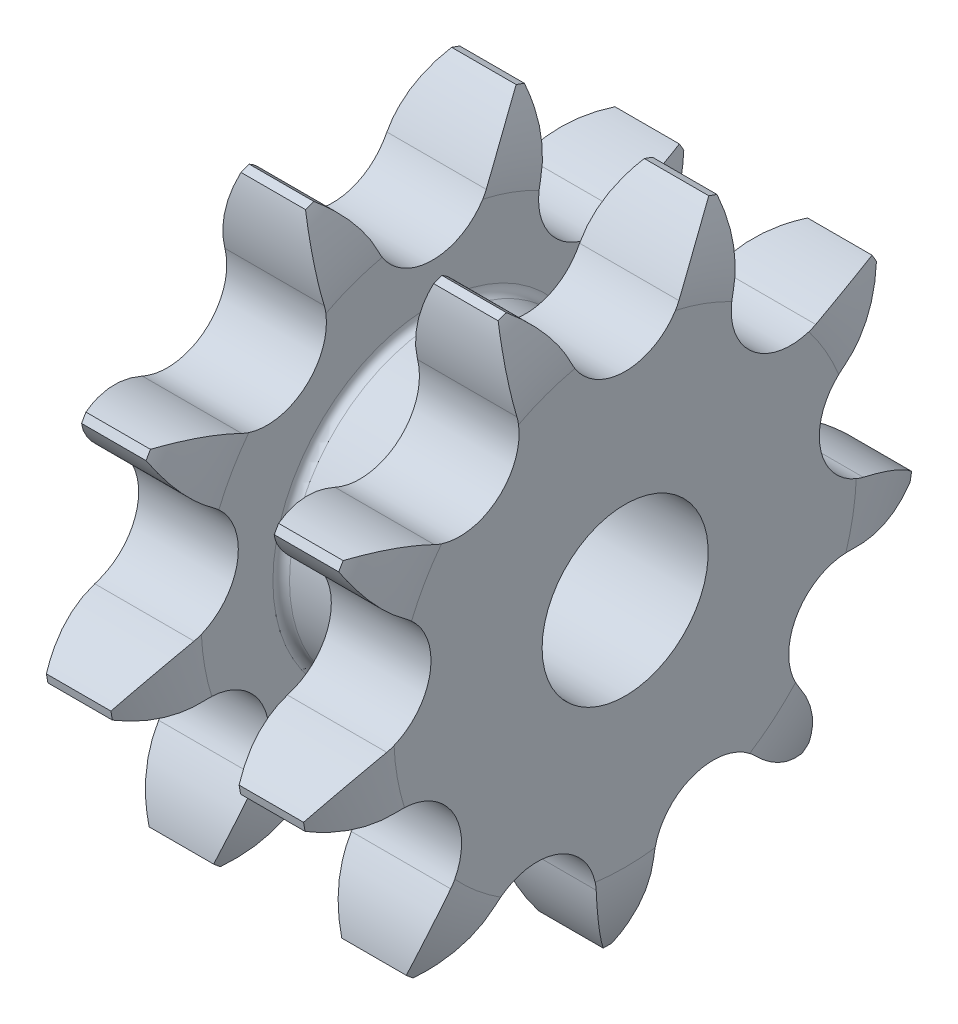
SolidWorks part; units mm, degrees
ref_plane "Plane1" through (0, 0, 0) normal (0, 0, 1) x (1, 0, 0)
ref_plane "Plane2" through (0, 0, 0) normal (0, 1, 0) x (1, 0, 0)
ref_plane "Plane3" through (0, 0, 0) normal (1, 0, 0) x (0, 0, -1)
sketch "Clipboard" plane through (0, 0, 0) normal (0, 1, 0) x (1, 0, 0)
  line L0 (0, 0) -> (12.5436, -1.9867)
  line L1 (-15, 0) -> (100, 0) construction
  line L2 (0, 0) -> (-0.8416, 0.9512)
  line L3 (0, 0) -> (-11.863, 4.5341)
  line L4 (0, 0) -> (3.0618, 0.4849)
  line L5 (0, 0) -> (-2.8109, -1.0484)
  line L6 (0, 0) -> (-17.5077, -11.8125)
  line L7 (-0.8416, 0.9512) -> (22.0505, 5.4009)
  line L8 (-76.2, 38.1) -> (-75.2, 38.1)
  line L9 (-73.4259, 41.6592) -> (-72.8306, 41.7344)
  line L10 (-73.4741, 12.7512) -> (-59.5541, 12.7512)
  circle A0 centre (0, 0) radius 4.255
  circle A1 centre (0, 0) radius 10.9305
  circle A2 centre (0, 0) radius 25
  dimension "Dr" = 8.51
  dimension "MHD" = 21.861
  dimension "Hub_dia" = 50
  dimension "Num_teeth" = 9
  dimension "Pitch" = 12.7
  dimension "Width" = 3.1
  dimension "Side_relief" = 1.27
  dimension "Side_radius" = 12.7
  dimension "Overall_len" = 3
  dimension "Show_teeth" = 9
  dimension "Thickness" = 21.12
  dimension "OAL" = 23.3205
  dimension "T_dim" = 1
  dimension "Fillet_rad" = 0.6
  dimension "Face_width" = 7.2
  dimension "Num_strands" = 2
  dimension "Transv_pitch" = 13.92
  dimension "Plate_wid" = 11.8
sketch "BasProSke" plane through (0, 0, 0) normal (0, 1, 0) x (1, 0, 0)
  line L0 (-10, 0) -> (60, 0) construction
  line L1 (0, 0) -> (0, 16.7129)
  line L2 (0, 0) -> (21.12, 0)
  line L3 (21.12, 0) -> (21.12, 16.7129)
  line L4 (19.85, 22.2487) -> (1.27, 22.2487)
  arc A0 (0, 16.7129) -> (1.27, 22.2487) centre (12.7, 16.7129) cw
  arc A1 (21.12, 16.7129) -> (19.85, 22.2487) centre (8.42, 16.7129) ccw
  dimension "D1" = 12.7
  dimension "G1" = 1.27
  dimension "G2" = 1.27
  dimension "Diameter" = 44.4973
  dimension "Thickness" = 21.12
revolve "Base-Revolve" add sketch "BasProSke" angle 360 about L0
sketch "GrvSke" plane through (0, 0, 0) normal (0, 1, 0) x (1, 0, 0)
  line L0 (7.2, 16.7129) -> (7.2, 11.5305)
  line L1 (7.8, 10.9305) -> (13.32, 10.9305)
  line L2 (13.92, 11.5305) -> (13.92, 16.7129)
  line L3 (5.93, 22.2487) -> (15.19, 22.2487)
  line L4 (10.56, 0) -> (10.56, 52.07) construction
  line L5 (-10, 0) -> (60, 0) construction
  line L6 (0, 0) -> (35.56, 0) construction
  arc A0 (13.92, 16.7129) -> (15.19, 22.2487) centre (26.62, 16.7129) cw
  arc A1 (7.2, 16.7129) -> (5.93, 22.2487) centre (-5.5, 16.7129) ccw
  arc A2 (7.2, 11.5305) -> (7.8, 10.9305) centre (7.8, 11.5305) ccw
  arc A3 (13.32, 10.9305) -> (13.92, 11.5305) centre (13.32, 11.5305) ccw
  dimension "D1" = 12.7
  dimension "Fillet_rad" = 0.6
  dimension "Diameter" = 44.4973
  dimension "Grv_diam" = 21.861
  dimension "Grv_width" = 6.72
  dimension "Offset" = 10.56
  dimension "G1" = 1.27
revolve "Groove" cut sketch "GrvSke" angle 360 about L6
sketch "TooCutSke" plane through (0, 0, 0) normal (1, 0, 0) x (0, 0, -1)
  line L0 (0, 18.6087) -> (3.8949, 16.7925) construction
  line L1 (0, 0) -> (0, 107) construction
  line L2 (0, 18.6087) -> (-10, 18.6087) construction
  line L3 (0, 18.6087) -> (-3.8949, 16.7925) construction
  arc A0 (3.8949, 16.7925) -> (7.8075, 21.3669) centre (14.0756, 12.0451) cw
  arc A1 (3.8949, 16.7925) -> (-3.8949, 16.7925) centre (0, 18.6087) cw
  arc A2 (-3.8949, 16.7925) -> (-7.8075, 21.3669) centre (-14.0756, 12.0451) ccw
  arc A3 (7.8075, 21.3669) -> (-7.8075, 21.3669) centre (0, 0) ccw
  dimension "R1" = 4.2976
  dimension "R2" = 11.2332
  dimension "Overcut" = 22.7487
  dimension "Seat_radius" = 18.6087
  dimension "X" = 130
extrude "ToothCut" cut sketch "TooCutSke" along normal through all
pattern_circular "TeethCuts" count 9 every 40 about axis through (-10, 0, 0) along (1, 0, 0) of "ToothCut"
sketch "HubNeaOneSke" plane through (0, 0, 0) normal (-1, 0, 0) x (0, 0, 1)
  circle A0 centre (0, 0) radius 10.9305
  dimension "Diameter" = 21.861
extrude "HubNearOne" [suppressed] add sketch "HubNeaOneSke" along normal blind 2.2005
fillet "HubNearOneFillet" [suppressed] radius 0.6
sketch "HubNeaBotSke" plane through (0, 0, 0) normal (-1, 0, 0) x (0, 0, 1)
  circle A0 centre (0, 0) radius 10.9305
  dimension "Diameter" = 21.861
extrude "HubNearBoth" [suppressed] add sketch "HubNeaBotSke" along normal blind 1.1003
fillet "HubNearBothFillet" [suppressed] radius 0.6
ref_plane "FarPln" through (21.12, 0, 0) normal (1, 0, 0) x (0, 0, -1)
sketch "HubFarSke" plane through (21.12, 0, 0) normal (1, 0, 0) x (0, 0, -1)
  circle A0 centre (0, 0) radius 10.9305
  dimension "Diameter" = 21.861
extrude "HubFar" [suppressed] add sketch "HubFarSke" along normal blind 1.1003
fillet "HubFarFillet" [suppressed] radius 0.6
sketch "BorSke" plane through (0, 0, 0) normal (1, 0, 0) x (0, 0, -1)
  circle A0 centre (0, 0) radius 6
  dimension "Diameter" = 12
extrude "Bore" cut sketch "BorSke" along normal mid plane 46.641
sketch "KeySke" plane through (0, 0, 0) normal (1, 0, 0) x (0, 0, -1)
  line L0 (-1, 0) -> (-1, 7)
  line L1 (-1, 7) -> (1, 7)
  line L2 (1, 7) -> (1, 0)
  line L3 (0, 0) -> (0, 34) construction
  line L4 (-1, 0) -> (1, 0)
  dimension "Offset" = 7
  dimension "Width" = 2
extrude "Keyway" [suppressed] cut sketch "KeySke" along normal mid plane 46.641
pattern_circular "Keyway2" [suppressed] count 2 every 90 about axis through (-10, 0, 0) along (1, 0, 0)
equation "' \"Pitch@Clipboard\" = 12.7"
equation "' \"Num_strands@Clipboard\" = 2"
equation "' \"Num_teeth@Clipboard\" = 9"
equation "' \"Hub_dia@Clipboard\" = 50"
equation "' \"Overall_len@Clipboard\" = 3"
equation "' \"Diameter@BorSke\" = 12"
equation "' \"T_dim@Clipboard\" = 1"
equation "' \"Width@KeySke\" = 2"
equation "' \"Dr@Clipboard\" = 8.51"
equation "' \"Face_width@Clipboard\" = 7.2"
equation "' \"Side_radius@Clipboard\" = 12.7"
equation "' \"Side_relief@Clipboard\" = 1.27"
equation "' \"Transv_pitch@Clipboard\" = 13.92"
equation "' \"Show_teeth@Clipboard\" = 9"
equation "' \"Fillet_rad@Clipboard\" = 0.6"
equation "' \"Plate_wid@Clipboard\" = 11.8"
equation "\"Num_teeth@Clipboard\" = int( \"Num_teeth@Clipboard\" )"
equation "\"Num_teeth@Clipboard\" = ((sgn( \"Num_teeth@Clipboard\" - 5.0)+1)*( \"Num_teeth@Clipboard\" - 5.0))/2 +5.0"
equation "\"Num_teeth@Clipboard\" = ((sgn( \"Num_teeth@Clipboard\" - 200.0)-1)*( \"Num_teeth@Clipboard\" - 200.0))/-2 +200.0"
equation "\"MHD@Clipboard\" = \"Pitch@Clipboard\" * (1.0 / tan(3.14159265 / \"Num_teeth@Clipboard\" )) - 1.04 * \"Plate_wid@Clipboard\" - 0.76"
equation "\"Thickness@Clipboard\"  = \"Face_width@Clipboard\" + (\"Num_strands@Clipboard\" - 1) * \"Transv_pitch@Clipboard\""
equation "\"OAL@Clipboard\" = \"Thickness@Clipboard\" + 2 * \"Fillet_rad@Clipboard\" + 1"
equation "\"MHD@Clipboard\" = ((sgn( \"MHD@Clipboard\" - \"Hub_dia@Clipboard\" )-1)*( \"MHD@Clipboard\" - \"Hub_dia@Clipboard\" ))/-2+ \"Hub_dia@Clipboard\""
equation "\"OAL@Clipboard\" = ((sgn( \"OAL@Clipboard\" - \"Overall_len@Clipboard\" )+1)*( \"OAL@Clipboard\" - \"Overall_len@Clipboard\" ))/2 + \"Overall_len@Clipboard\" + 0.0005"
equation "\"Num_teeth@TeethCuts\" = int( \"Show_teeth@Clipboard\" ) + 1"
equation "\"Num_teeth@TeethCuts\" = ((sgn( \"Num_teeth@TeethCuts\" - \"Num_teeth@Clipboard\" )-1)*( \"Num_teeth@TeethCuts\" - \"Num_teeth@Clipboard\" ))/-2+ \"Num_teeth@Clipboard\""
equation "\"Num_teeth@TeethCuts\" = ((sgn( \"Num_teeth@TeethCuts\" - 2.0)+1)*( \"Num_teeth@TeethCuts\" - 2.0))/2 +2.0"
equation "\"Angle@TeethCuts\" = 360.0 / \"Num_teeth@Clipboard\""
equation "\"Seat_radius@TooCutSke\" = ( \"Pitch@Clipboard\" / 2.0) / sin(3.14159265 / \"Num_teeth@Clipboard\" ) - \"Dr@Clipboard\" / 2.0 + \"Dr@Clipboard\" * 0.505"
equation "\"R1@TooCutSke\"  = \"Dr@Clipboard\" * 0.505"
equation "\"X@TooCutSke\" = 140.0 - (90.0 / \"Num_teeth@Clipboard\")"
equation "\"R2@TooCutSke\" = 0.12 * \"Dr@Clipboard\" * ( \"Num_teeth@Clipboard\" + 2.0)"
equation "\"Overcut@TooCutSke\" = 0.5 + 0.625 * \"Pitch@Clipboard\" - 0.5 * \"Dr@Clipboard\"  +  \"Pitch@Clipboard\" / 2.0 / sin(3.14159265 / \"Num_teeth@Clipboard\" )"
equation "\"Diameter@BasProSke\" = 2.0 * ( 0.625 * \"Pitch@Clipboard\" - 0.5 * \"Dr@Clipboard\"  +  \"Pitch@Clipboard\" / 2.0 / sin(3.14159265 / \"Num_teeth@Clipboard\" ))"
equation "\"Thickness@BasProSke\"  = \"Thickness@Clipboard\""
equation "\"G1@BasProSke\" =  \"Side_relief@Clipboard\""
equation "\"G2@BasProSke\" =  \"Side_relief@Clipboard\""
equation "\"D1@BasProSke\" =  \"Side_radius@Clipboard\""
equation "\"Diameter@GrvSke\" = \"Diameter@BasProSke\""
equation "\"G1@GrvSke\" = \"Side_relief@Clipboard\""
equation "\"D1@GrvSke\" = \"Side_radius@Clipboard\""
equation "\"Grv_diam@GrvSke\" =  \"Pitch@Clipboard\" * (1.0 / tan(3.14159265 / \"Num_teeth@Clipboard\" ))- 1.04 * \"Plate_wid@Clipboard\" - 0.76"
equation "\"Grv_width@GrvSke\" =  \"Transv_pitch@Clipboard\" - \"Face_width@Clipboard\""
equation "\"Offset@GrvSke\" = \"Grv_width@GrvSke\" / 2.0 + \"Face_width@Clipboard\""
equation "\"Fillet_rad@GrvSke\" = \"Fillet_rad@Clipboard\""
equation "\"Diameter@HubNeaOneSke\" = \"MHD@Clipboard\""
equation "\"Length@HubNearOne\" = \"OAL@Clipboard\" - \"Thickness@BasProSke\""
equation "\"Diameter@HubNeaBotSke\" = \"MHD@Clipboard\""
equation "\"Length@HubNearBoth\" = ( \"OAL@Clipboard\" - \"Thickness@BasProSke\" ) / 2.0"
equation "\"D1@HubNearOneFillet\" = \"Fillet_rad@Clipboard\""
equation "\"D1@HubNearBothFillet\" = \"Fillet_rad@Clipboard\""
equation "\"Thickness@FarPln\" = \"Thickness@BasProSke\""
equation "\"Diameter@HubFarSke\" = \"MHD@Clipboard\""
equation "\"Length@HubFar\" = ( \"OAL@Clipboard\" - \"Thickness@BasProSke\" ) / 2.0"
equation "\"D1@HubFarFillet\" = \"Fillet_rad@Clipboard\""
equation "\"D1@Bore\" = \"OAL@Clipboard\" * 2.0"
equation "\"D1@Keyway\" = \"OAL@Clipboard\" * 2.0"
equation "\"Offset@KeySke\" = \"T_dim@Clipboard\" + \"Diameter@BorSke\" / 2.0"
